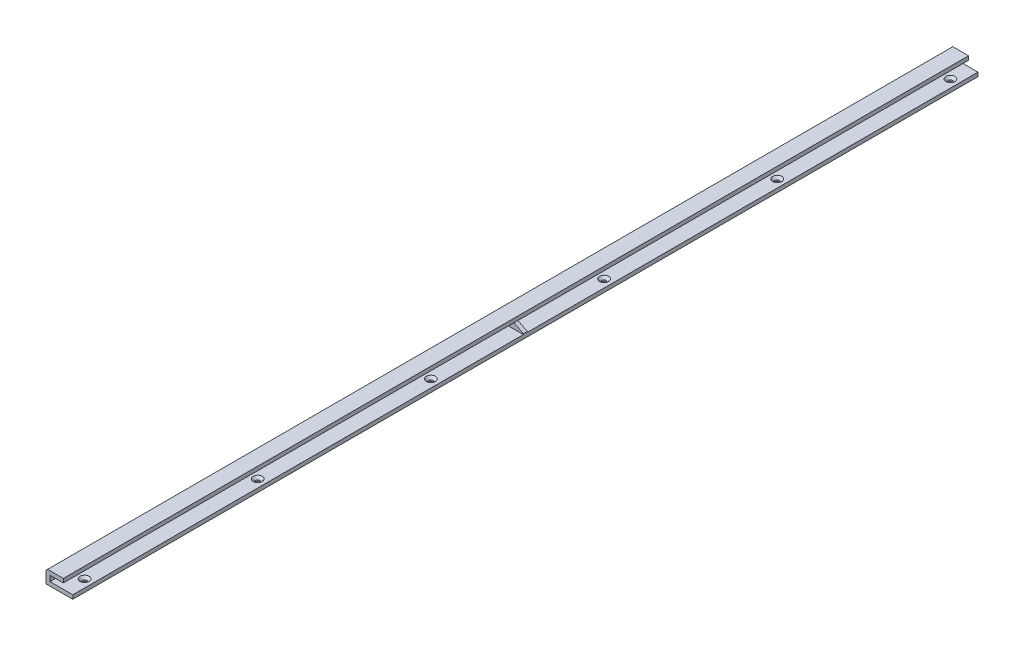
SolidWorks part; units mm, degrees
ref_plane "Plan de face" through (0, 0, 0) normal (0, 0, 1) x (1, 0, 0)
ref_plane "Plan de dessus" through (0, 0, 0) normal (0, 1, 0) x (1, 0, 0)
ref_plane "Plan de droite" through (0, 0, 0) normal (1, 0, 0) x (0, 0, -1)
sketch "Esquisse3" plane through (0, 0, 0) normal (0, 1, 0) x (1, 0, 0)
  line L0 (10, 0) -> (10, 1150) construction
  line L1 (0, 0) -> (20, 0)
  line L2 (0, 0) -> (0, 1150)
  line L3 (0, 1150) -> (20, 1150)
  line L4 (20, 0) -> (20, 1150)
  circle A0 centre (10, 25) radius 2.75
  circle A1 centre (10, 245) radius 2.75
  circle A2 centre (10, 465) radius 2.75
  circle A3 centre (10, 685) radius 2.75
  circle A4 centre (10, 905) radius 2.75
  circle A5 centre (10, 1125) radius 2.75
  dimension "D3" = 5.5
  dimension "D4" = 25
  dimension "D1" = 20
  dimension "D2" = 1150
  dimension "D5" = 6
extrude "Boss.-Extru.1" add sketch "Esquisse3" along normal blind 5
sketch "Esquisse4" plane through (0, 0, 0) normal (0, 0, 1) x (1, 0, 0)
  line L0 (0, 5) -> (20, 5) construction
  line L1 (0, 0) -> (-14, 0)
  line L2 (0, 0) -> (0, 5)
  line L3 (0, 17) -> (-12, 17)
  line L4 (-14, 0) -> (-14, 15)
  line L5 (-14, 15) -> (-12, 17)
  line L6 (0, 17) -> (8, 17)
  line L8 (0, 12) -> (8, 12)
  line L9 (8, 17) -> (8, 12)
  line L10 (0, 5) -> (-9, 5)
  line L12 (0, 12) -> (-9, 12)
  line L13 (-9, 5) -> (-9, 12)
  point P1 (-14, 17)
  dimension "D1" = 14
  dimension "D2" = 12
  dimension "D3" = 8
  dimension "D4" = 5
  dimension "D5" = 2
  dimension "D6" = 45
  dimension "D7" = 9
extrude "Boss.-Extru.2" add sketch "Esquisse4" against normal blind 1150
sketch "Esquisse5" plane through (0, 5, 0) normal (0, 1, 0) x (1, 0, 0)
  line L0 (20, 0) -> (20, 1150) construction
  line L1 (20, 577.5) -> (-9, 577.5)
  line L2 (20, 577.5) -> (20, 572.5)
  line L3 (20, 572.5) -> (-9, 572.5)
  line L4 (-9, 577.5) -> (-9, 572.5)
  line L5 (-9, 0) -> (20, 0) construction
  dimension "D1" = 5
  dimension "D2" = 29
  dimension "D3" = 572.5
extrude "Boss.-Extru.3" add sketch "Esquisse5" along normal blind 7
chamfer "Chanfrein1" distance 6 distance2 12 1 edges at (20, 12, -575)
chamfer "Chanfrein2" distance 3 angle 45 6 edges at (10, 5, -22.25) (10, 5, -1122.25) (10, 5, -902.25) (10, 5, -682.25) (10, 5, -462.25) (10, 5, -242.25)
